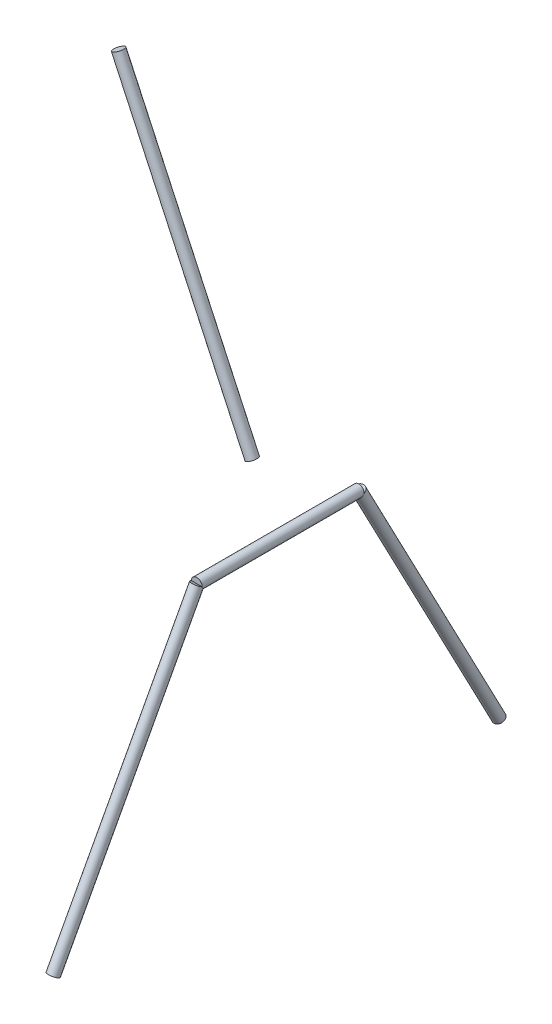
SolidWorks part; units mm, degrees
ref_plane "Alzado" through (0, 0, 0) normal (0, 0, 1) x (1, 0, 0)
ref_plane "Planta" through (0, 0, 0) normal (0, 1, 0) x (1, 0, 0)
ref_plane "Vista lateral" through (0, 0, 0) normal (1, 0, 0) x (0, 0, -1)
sketch3d "Sk_Cable_puente_1"
  line L0 (424.6109, 411.5791, -33) -> (424.8763, 451.3903, -12)
  dimension "D1" = 45.0111
sweep "Cable_puente_1" add path "Sk_Cable_puente_1" parameters "D3"=1.6
sketch3d "Sk_Cable_puente_2"
  line L0 (424.8763, 451.3903, -12) -> (424.8763, 451.3903, 12)
sweep "Cable_puente_2" add path "Sk_Cable_puente_2" parameters "D3"=1.6
sketch3d "Sk_Cable_puente_3"
  line L0 (424.8763, 451.3903, 12) -> (424.6109, 411.5791, 33)
  dimension "D1" = 45.0111
sweep "Cable_puente_3" add path "Sk_Cable_puente_3" parameters "D3"=1.6
sketch3d "Sk_Cable_tiro"
  line L0 (421.0876, 459.554, 0) -> (401.3021, 502.1865, 0)
  dimension "D1" = 47
sweep "Cable_tiro" add path "Sk_Cable_tiro" parameters "D3"=1.6
